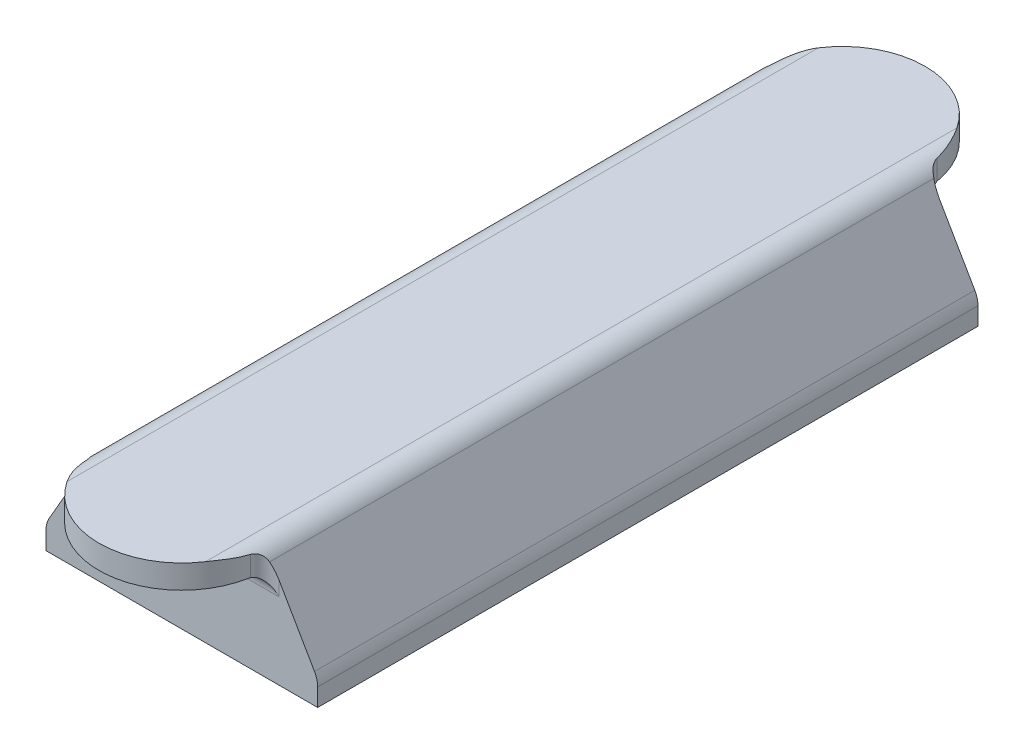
SolidWorks part; units mm, degrees
ref_plane "前视基准面" through (0, 0, 0) normal (0, 0, 1) x (1, 0, 0)
ref_plane "上视基准面" through (0, 0, 0) normal (0, 1, 0) x (1, 0, 0)
ref_plane "右视基准面" through (0, 0, 0) normal (1, 0, 0) x (0, 0, -1)
sketch "Sketch1" plane through (0, 0, 0) normal (0, 0, 1) x (1, 0, 0)
  line L0 (0, 0) -> (0, -23) construction
  line L1 (0, 0) -> (-13.2791, -23) construction
  line L2 (-13.2791, -23) -> (13.2791, -23) construction
  line L3 (13.2791, -23) -> (0, 0) construction
  circle A0 centre (0, 0) radius 13.4 construction
  dimension "D1" = 26.8
  dimension "D2" = 23
  dimension "D3" = 30
sketch "Sketch2" plane through (0, 0, 0) normal (0, 0, 1) x (1, 0, 0)
  line L0 (13.2791, -23) -> (0, 0) construction
  line L1 (0, 0) -> (-13.2791, -23) construction
  line L2 (13.2791, -23) -> (6.7, -11.6047)
  line L3 (-6.7, -11.6047) -> (-13.2791, -23)
  line L4 (-10.5462, -8.2666) -> (-19.0526, -23)
  line L5 (19.0526, -23) -> (10.5462, -8.2666)
  line L6 (-7.705, -3.3455) -> (-17.6092, -20.5) construction
  line L7 (17.6092, -20.5) -> (7.705, -3.3455) construction
  line L8 (-10.5462, -8.2666) -> (10.5462, -8.2666)
  line L9 (-19.0526, -23) -> (-13.2791, -23)
  line L10 (13.2791, -23) -> (19.0526, -23)
  line L11 (-17.2791, -23) -> (-17.2791, -19.9282)
  line L12 (17.2791, -23) -> (17.2791, -19.9282)
  circle A0 centre (0, 0) radius 13.4 construction
  arc A1 (-6.7, -11.6047) -> (6.7, -11.6047) centre (0, 0) ccw
  arc A4 (-7.705, -3.3455) -> (7.705, -3.3455) centre (0, 0) ccw construction
  dimension "D2" = 4
  dimension "D3" = 4
  dimension "D1" = 5
extrude "Boss-Extrude1" add sketch "Sketch2" along normal mid plane 16 contours L3 A1 L2 L10 L12 L5 L8 L4 L11 L9
sketch "Sketch3" plane through (0, 0, 8) normal (0, 0, 1) x (1, 0, 0)
  line L0 (-13.2791, -23) -> (13.2791, -23)
  line L9 (-13.2791, -23) -> (-6.7, -11.6047)
  line L10 (6.7, -11.6047) -> (13.2791, -23)
  line L11 (13.2791, -23) -> (17.2791, -23)
  line L12 (17.2791, -23) -> (17.2791, -19.9282)
  line L13 (17.2791, -19.9282) -> (10.5462, -8.2666)
  line L14 (10.5462, -8.2666) -> (-10.5462, -8.2666)
  line L15 (-10.5462, -8.2666) -> (-17.2791, -19.9282)
  line L16 (-17.2791, -19.9282) -> (-17.2791, -23)
  line L17 (-17.2791, -23) -> (-13.2791, -23)
  line L18 (-13.2791, -23) -> (-6.7, -11.6047)
  line L19 (6.7, -11.6047) -> (13.2791, -23)
  line L20 (13.2791, -23) -> (17.2791, -23)
  line L21 (17.2791, -23) -> (17.2791, -19.9282)
  line L22 (17.2791, -19.9282) -> (10.5462, -8.2666)
  line L23 (10.5462, -8.2666) -> (-10.5462, -8.2666)
  line L24 (-10.5462, -8.2666) -> (-17.2791, -19.9282)
  line L25 (-17.2791, -19.9282) -> (-17.2791, -23)
  line L26 (-17.2791, -23) -> (-13.2791, -23)
  arc A1 (-6.7, -11.6047) -> (6.7, -11.6047) centre (0, 0) ccw
  arc A2 (-6.7, -11.6047) -> (6.7, -11.6047) centre (0, 0) ccw
  dimension "D1" = 0
extrude "Boss-Extrude3" add sketch "Sketch3" along normal blind 2 contours L0 M11 M13 M12 | M20 M11 M12 M13 M14 M15 M16 M17 M18 M19
sketch "Sketch5" plane through (0, 0, -8) normal (0, 0, -1) x (-1, 0, 0)
  line L0 (13.2791, -23) -> (-13.2791, -23) construction
  line L1 (13.2791, -23) -> (6.7, -11.6047) construction
  line L2 (-6.7, -11.6047) -> (-13.2791, -23) construction
  line L3 (-13.2791, -23) -> (-17.2791, -23) construction
  line L4 (-17.2791, -23) -> (-17.2791, -19.9282) construction
  line L5 (-17.2791, -19.9282) -> (-10.5462, -8.2666) construction
  line L6 (-10.5462, -8.2666) -> (10.5462, -8.2666) construction
  line L7 (10.5462, -8.2666) -> (17.2791, -19.9282) construction
  line L8 (17.2791, -19.9282) -> (17.2791, -23) construction
  line L9 (17.2791, -23) -> (13.2791, -23) construction
  line L10 (13.2791, -23) -> (-13.2791, -23)
  line L11 (13.2791, -23) -> (6.7, -11.6047)
  line L12 (-6.7, -11.6047) -> (-13.2791, -23)
  line L13 (-13.2791, -23) -> (-17.2791, -23)
  line L14 (-17.2791, -23) -> (-17.2791, -19.9282)
  line L15 (-17.2791, -19.9282) -> (-10.5462, -8.2666)
  line L16 (-10.5462, -8.2666) -> (10.5462, -8.2666)
  line L17 (10.5462, -8.2666) -> (17.2791, -19.9282)
  line L18 (17.2791, -19.9282) -> (17.2791, -23)
  line L19 (17.2791, -23) -> (13.2791, -23)
  arc A0 (-6.7, -11.6047) -> (6.7, -11.6047) centre (0, 0) ccw construction
  arc A1 (-6.7, -11.6047) -> (6.7, -11.6047) centre (0, 0) ccw
extrude "Boss-Extrude5" add sketch "Sketch5" along normal blind 2 contours M10 M1 M2 M3 M4 M5 M6 M7 M8 M9 | L10 M1 M10 M9
fillet "Fillet3" radius 1 8 edges at (-6.7, -11.6047, 0) (0, -13.4, 8) (6.7, -11.6047, 0) (0, -13.4, -8) (-9.9895, -17.3024, -8) (-9.9895, -17.3024, 8) (9.9895, -17.3024, 8) (9.9895, -17.3024, -8)
pattern_linear "LPattern4" count 4 spacing 20 along (0, 0, 1) of "Boss-Extrude1", "Boss-Extrude3", "Boss-Extrude5"
combine bodies "Combine1" operation type add bodies to combine 113 114 115 114 115 117
sketch "Sketch6" plane through (0, 0, -10) normal (0, 0, -1) x (-1, 0, 0)
  line L6 (-17.2791, -19.9282) -> (-17.2791, -23)
  line L7 (-17.2791, -23) -> (17.2791, -23)
  line L8 (17.2791, -23) -> (17.2791, -19.9282)
  line L9 (17.2791, -19.9282) -> (10.5462, -8.2666)
  line L10 (10.5462, -8.2666) -> (-10.5462, -8.2666)
  line L11 (-10.5462, -8.2666) -> (-17.2791, -19.9282)
  line L12 (-17.2791, -19.9282) -> (-17.2791, -23)
  line L13 (-17.2791, -23) -> (17.2791, -23)
  line L14 (17.2791, -23) -> (17.2791, -19.9282)
  line L15 (17.2791, -19.9282) -> (10.5462, -8.2666)
  line L16 (10.5462, -8.2666) -> (-10.5462, -8.2666)
  line L17 (-10.5462, -8.2666) -> (-17.2791, -19.9282)
  dimension "D1" = 0
extrude "Boss-Extrude6" add sketch "Sketch6" along normal blind 2
sketch "Sketch7" plane through (0, 0, 70) normal (0, 0, 1) x (1, 0, 0)
  line L6 (-17.2791, -23) -> (17.2791, -23)
  line L7 (17.2791, -23) -> (17.2791, -19.9282)
  line L8 (17.2791, -19.9282) -> (10.5462, -8.2666)
  line L9 (10.5462, -8.2666) -> (-10.5462, -8.2666)
  line L10 (-10.5462, -8.2666) -> (-17.2791, -19.9282)
  line L11 (-17.2791, -19.9282) -> (-17.2791, -23)
  line L12 (-17.2791, -23) -> (17.2791, -23)
  line L13 (17.2791, -23) -> (17.2791, -19.9282)
  line L14 (17.2791, -19.9282) -> (10.5462, -8.2666)
  line L15 (10.5462, -8.2666) -> (-10.5462, -8.2666)
  line L16 (-10.5462, -8.2666) -> (-17.2791, -19.9282)
  line L17 (-17.2791, -19.9282) -> (-17.2791, -23)
  dimension "D1" = 0
extrude "Boss-Extrude7" add sketch "Sketch7" along normal blind 2
sketch "Sketch8" plane through (0, -8.2666, 0) normal (0, 1, 0) x (1, 0, 0)
  line L0 (0, -72) -> (0, 12) construction
  line L1 (-10.5462, 12) -> (10.5462, 12) construction
  line L2 (-10.5462, -72) -> (-10.5462, 12)
  line L3 (10.5462, -72) -> (10.5462, 12)
  line L4 (10.5462, -72) -> (10.5462, 12) construction
  line L5 (17.2791, -72) -> (10.5462, -72) construction
  arc A0 (-10.5462, -72) -> (10.5462, -72) centre (0, -72) ccw
  arc A1 (10.5462, 12) -> (-10.5462, 12) centre (0, 12) ccw
  point P4 (0, -30)
extrude "Boss-Extrude8" add sketch "Sketch8" against normal blind 3 contours A1 M6 | A0 M8
fillet "Fillet4" radius 2 6 edges at (10.5462, -9.7666, -12) (-10.5462, -9.7666, -12) (-10.5462, -9.7666, 72) (10.5462, -9.7666, 72) (0, -11.2666, 72) (0, -11.2666, -12)
fillet "Fillet5" radius 3 4 edges at (-10.5462, -8.2666, 30) (10.5462, -8.2666, 30) (17.2791, -19.9282, 30) (-17.2791, -19.9282, 30)
